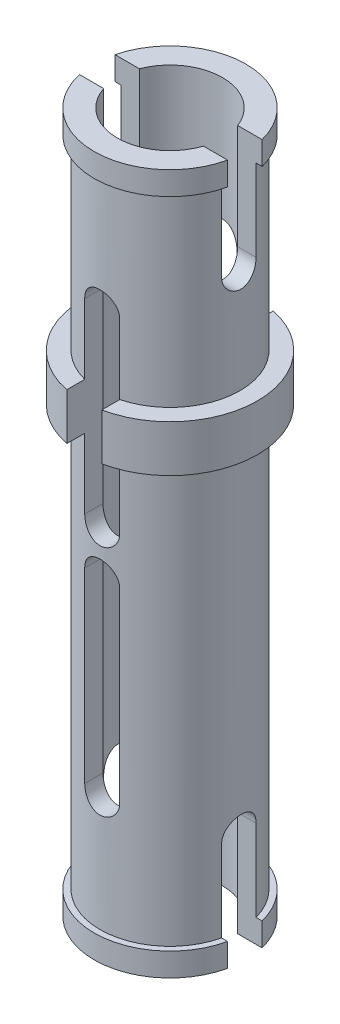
SolidWorks part; units mm, degrees
ref_plane "Front Plane" through (0, 0, 0) normal (0, 0, 1) x (1, 0, 0)
ref_plane "Top Plane" through (0, 0, 0) normal (0, 1, 0) x (1, 0, 0)
ref_plane "Right Plane" through (0, 0, 0) normal (1, 0, 0) x (0, 0, -1)
sketch "Sketch1" plane through (0, 0, 0) normal (0, 1, 0) x (1, 0, 0)
  circle A0 centre (0, 0) radius 2.4
extrude "Boss-Extrude1" add sketch "Sketch1" along normal blind 8 and the other way blind 16
sketch "Sketch2" plane through (0, 0, 0) normal (0, 1, 0) x (1, 0, 0)
  circle A0 centre (0, 0) radius 3
extrude "Boss-Extrude2" add sketch "Sketch2" along normal blind 0.8 and the other way blind 0.8
sketch "Sketch4" plane through (0, 8, 0) normal (0, 1, 0) x (1, 0, 0)
  circle A0 centre (0, 0) radius 2.6
extrude "Boss-Extrude3" add sketch "Sketch4" against normal blind 0.8
sketch "Sketch6" plane through (0, -16, 0) normal (0, -1, 0) x (1, 0, 0)
  circle A0 centre (0, 0) radius 2.6
extrude "Boss-Extrude5" add sketch "Sketch6" against normal blind 0.8
sketch "Sketch7" plane through (0, 8, 0) normal (0, 1, 0) x (1, 0, 0)
  circle A0 centre (0, 0) radius 1.8
extrude "Cut-Extrude2" cut sketch "Sketch7" against normal up to next
sketch "Sketch8" plane through (0, 0, 0) normal (0, 0, 1) x (1, 0, 0)
  line L0 (-0.6, 3.2) -> (-0.6, -3.2)
  line L1 (0.6, 3.2) -> (0.6, -3.2)
  line L2 (-2.4, 7.2) -> (-2.4, 0.8) construction
  line L3 (1.8, 8) -> (-1.8, 8) construction
  line L4 (-0.6, -4.8) -> (-0.6, -11.2)
  line L5 (2.6, 8) -> (-2.6, 8) construction
  line L6 (0.6, -4.8) -> (0.6, -11.2)
  arc A0 (-0.6, 3.2) -> (0.6, 3.2) centre (0, 3.2) cw
  arc A1 (0.6, -3.2) -> (-0.6, -3.2) centre (0, -3.2) cw
  arc A2 (-0.6, -4.8) -> (0.6, -4.8) centre (0, -4.8) cw
  arc A3 (0.6, -11.2) -> (-0.6, -11.2) centre (0, -11.2) cw
  dimension "D1" = 1.2
  dimension "D2" = 1.8
  dimension "D3" = 6.4
  dimension "D4" = 6.4
  dimension "D5" = 4.8
  dimension "D6" = 4.8
  dimension "D7" = 2
extrude "Cut-Extrude3" cut sketch "Sketch8" against normal up to next and the other way up to next
sketch "Sketch9" plane through (0, 0, 0) normal (1, 0, 0) x (0, 0, -1)
  line L0 (-0.564, 8) -> (-0.564, 4.4)
  line L1 (2.6, 8) -> (-2.6, 8) construction
  line L2 (0.636, 8) -> (0.636, 4.4)
  line L3 (-0.564, -16) -> (-0.564, -12.4)
  line L4 (0.636, -16) -> (0.636, -12.4)
  line L5 (-2.6, -16) -> (2.6, -16) construction
  line L6 (-0.564, 8) -> (0.636, 8)
  line L7 (-0.564, -16) -> (0.636, -16)
  arc A0 (-0.564, -12.4) -> (0.636, -12.4) centre (0.036, -12.4) cw
  arc A1 (0.636, 4.4) -> (-0.564, 4.4) centre (0.036, 4.4) cw
  dimension "D1" = 1.2
  dimension "D2" = 3.6
  dimension "D3" = 3.6
  dimension "D4" = 3.6
  dimension "D5" = 0
  dimension "D6" = 3.6
extrude "Cut-Extrude4" cut sketch "Sketch9" against normal up to next and the other way up to next
